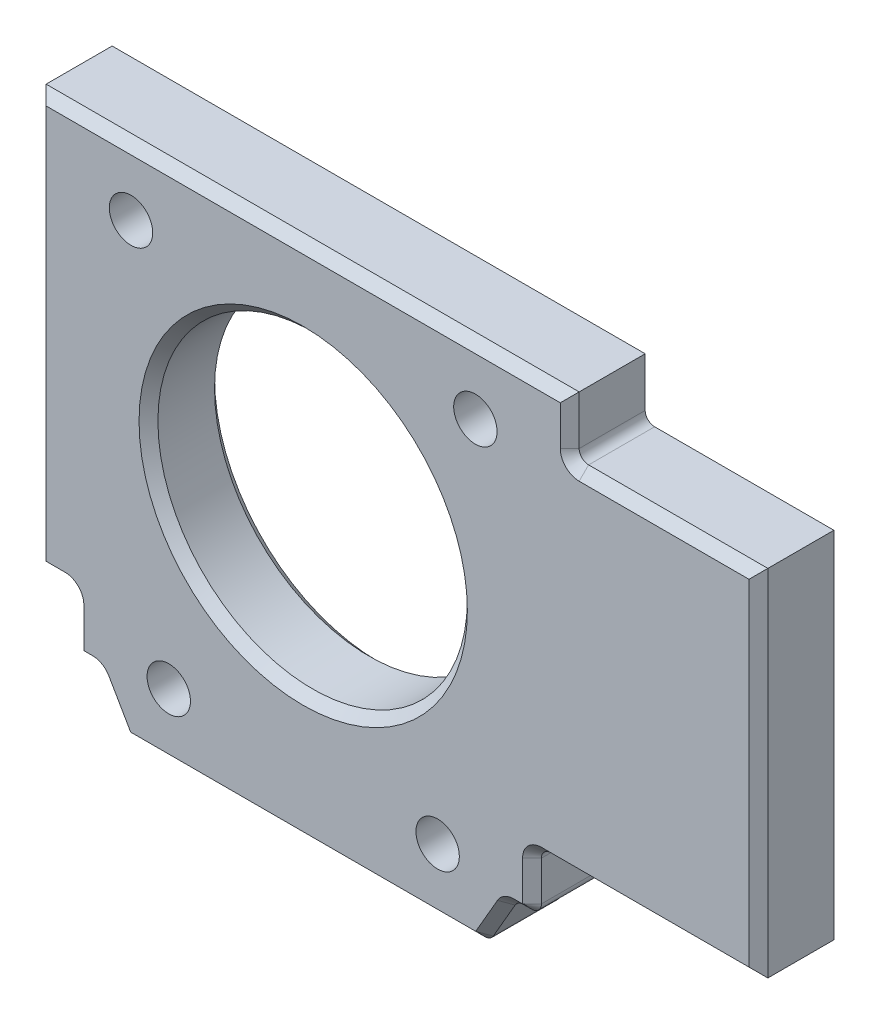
SolidWorks part; units mm, degrees
ref_plane "Front Plane" through (0, 0, 0) normal (0, 0, 1) x (1, 0, 0)
ref_plane "Top Plane" through (0, 0, 0) normal (0, 1, 0) x (1, 0, 0)
ref_plane "Right Plane" through (0, 0, 0) normal (1, 0, 0) x (0, 0, -1)
sketch "Sketch2" plane through (0, 0, 0) normal (0, 0, 1) x (1, 0, 0)
  line L14 (-38.5, -17.7799) -> (-38.5, -39.1799)
  line L15 (-38, -39.6799) -> (-37, -39.6799)
  line L16 (-36.5, -40.1799) -> (-36.5, -42.2799)
  line L17 (-36, -42.7799) -> (-35.5387, -42.7799)
  line L18 (-35.1057, -43.0299) -> (-33.951, -45.0299)
  line L19 (-33.5179, -45.2799) -> (-15.2321, -45.2799)
  line L20 (-14.799, -45.0299) -> (-13.6443, -43.0299)
  line L21 (-13.2113, -42.7799) -> (-12.75, -42.7799)
  line L22 (-12.25, -42.2799) -> (-12.25, -40.1799)
  line L23 (-11.75, -39.6799) -> (-0.25, -39.6799)
  line L24 (-0.25, -39.6799) -> (-0.25, -20.8799)
  line L25 (-0.25, -20.8799) -> (-9.75, -20.8799)
  line L26 (-10.25, -20.3799) -> (-10.25, -17.7799)
  line L27 (-10.25, -17.7799) -> (-38.5, -17.7799)
  line L28 (-38.5, -17.7799) -> (-38.5, -39.1799)
  line L29 (-38, -39.6799) -> (-37, -39.6799)
  line L30 (-36.5, -40.1799) -> (-36.5, -42.2799)
  line L31 (-36, -42.7799) -> (-35.5387, -42.7799)
  line L32 (-35.1057, -43.0299) -> (-33.951, -45.0299)
  line L33 (-33.5179, -45.2799) -> (-15.2321, -45.2799)
  line L34 (-14.799, -45.0299) -> (-13.6443, -43.0299)
  line L35 (-13.2113, -42.7799) -> (-12.75, -42.7799)
  line L36 (-12.25, -42.2799) -> (-12.25, -40.1799)
  line L38 (-0.25, -39.6799) -> (-0.25, -20.8799)
  line L39 (-0.25, -20.8799) -> (-9.75, -20.8799)
  line L40 (-10.25, -20.3799) -> (-10.25, -17.7799)
  line L41 (-10.25, -17.7799) -> (-38.5, -17.7799)
  line L263 (-11.75, -39.6799) -> (-0.25, -39.6799)
  circle A0 centre (-24.375, -30.2799) radius 8.2
  arc A10 (-38.5, -39.1799) -> (-38, -39.6799) centre (-38, -39.1799) ccw
  arc A11 (-36.5, -40.1799) -> (-37, -39.6799) centre (-37, -40.1799) ccw
  arc A12 (-36.5, -42.2799) -> (-36, -42.7799) centre (-36, -42.2799) ccw
  arc A13 (-35.1057, -43.0299) -> (-35.5387, -42.7799) centre (-35.5387, -43.2799) ccw
  arc A14 (-33.951, -45.0299) -> (-33.5179, -45.2799) centre (-33.5179, -44.7799) ccw
  arc A15 (-15.2321, -45.2799) -> (-14.799, -45.0299) centre (-15.2321, -44.7799) ccw
  arc A16 (-13.2113, -42.7799) -> (-13.6443, -43.0299) centre (-13.2113, -43.2799) ccw
  arc A17 (-12.75, -42.7799) -> (-12.25, -42.2799) centre (-12.75, -42.2799) ccw
  arc A18 (-11.75, -39.6799) -> (-12.25, -40.1799) centre (-11.75, -40.1799) ccw
  arc A19 (-10.25, -20.3799) -> (-9.75, -20.8799) centre (-9.75, -20.3799) ccw
  arc A20 (-38.5, -39.1799) -> (-38, -39.6799) centre (-38, -39.1799) ccw
  arc A21 (-36.5, -40.1799) -> (-37, -39.6799) centre (-37, -40.1799) ccw
  arc A22 (-36.5, -42.2799) -> (-36, -42.7799) centre (-36, -42.2799) ccw
  arc A23 (-35.1057, -43.0299) -> (-35.5387, -42.7799) centre (-35.5387, -43.2799) ccw
  arc A24 (-33.951, -45.0299) -> (-33.5179, -45.2799) centre (-33.5179, -44.7799) ccw
  arc A25 (-15.2321, -45.2799) -> (-14.799, -45.0299) centre (-15.2321, -44.7799) ccw
  arc A26 (-13.2113, -42.7799) -> (-13.6443, -43.0299) centre (-13.2113, -43.2799) ccw
  arc A27 (-12.75, -42.7799) -> (-12.25, -42.2799) centre (-12.75, -42.2799) ccw
  arc A29 (-10.25, -20.3799) -> (-9.75, -20.8799) centre (-9.75, -20.3799) ccw
  arc A62 (-24.375, -24.0799) -> (-18.4776, -32.1932) centre (-24.375, -30.2799) ccw construction
  arc A63 (-24.375, -24.0799) -> (-18.4776, -32.1932) centre (-24.375, -30.2799) ccw construction
  arc A194 (-11.75, -39.6799) -> (-12.25, -40.1799) centre (-11.75, -40.1799) ccw
  dimension "D2" = 2
  dimension "D1" = 0
extrude "Boss-Extrude1" add sketch "Sketch2" along normal blind 4
chamfer "Chamfer1" distance 0.5 angle 45 26 edges at (-16.175, -30.2799, 4) (-10.25, -19.0799, 4) (-10.1036, -20.7335, 4) (-5, -20.8799, 4) (-0.25, -30.2799, 4) (-6, -39.6799, 4) (-12.1036, -39.8264, 4) (-12.25, -41.2299, 4) (-12.3964, -42.6335, 4) (-12.9807, -42.7799, 4) (-13.4613, -42.8469, 4) (-14.2217, -44.0299, 4) (-14.9821, -45.2129, 4) (-24.375, -45.2799, 4) (-33.7679, -45.2129, 4) (-34.5283, -44.0299, 4) (-35.2887, -42.8469, 4) (-35.7693, -42.7799, 4) (-36.3536, -42.6335, 4) (-36.5, -41.2299, 4) (-36.6464, -39.8264, 4) (-37.5, -39.6799, 4) (-38.3536, -39.5335, 4) (-38.5, -28.4799, 4) (-24.375, -17.7799, 4) (-16.175, -30.2799, 0)
sketch "Sketch4" plane through (0, 0, 4) normal (0, 0, 1) x (1, 0, 0)
  circle A3 centre (-15.25, -21.2799) radius 1 construction
  circle A12 centre (-17.25, -41.7799) radius 1 construction
  circle A14 centre (-31.5, -41.7799) radius 1 construction
  circle A17 centre (-33.5, -21.2799) radius 1 construction
  circle A33 centre (-17.25, -41.7799) radius 1 construction
  circle A34 centre (-31.5, -41.7799) radius 1 construction
  circle A35 centre (-33.5, -21.2799) radius 1 construction
  circle A36 centre (-15.25, -21.2799) radius 1 construction
  circle A37 centre (-15.25, -21.2799) radius 1.15
  circle A38 centre (-33.5, -21.2799) radius 1.15
  circle A39 centre (-31.5, -41.7799) radius 1.15
  circle A40 centre (-17.25, -41.7799) radius 1.15
  dimension "D1" = 0.15
extrude "Cut-Extrude1" cut sketch "Sketch4" against normal through all
